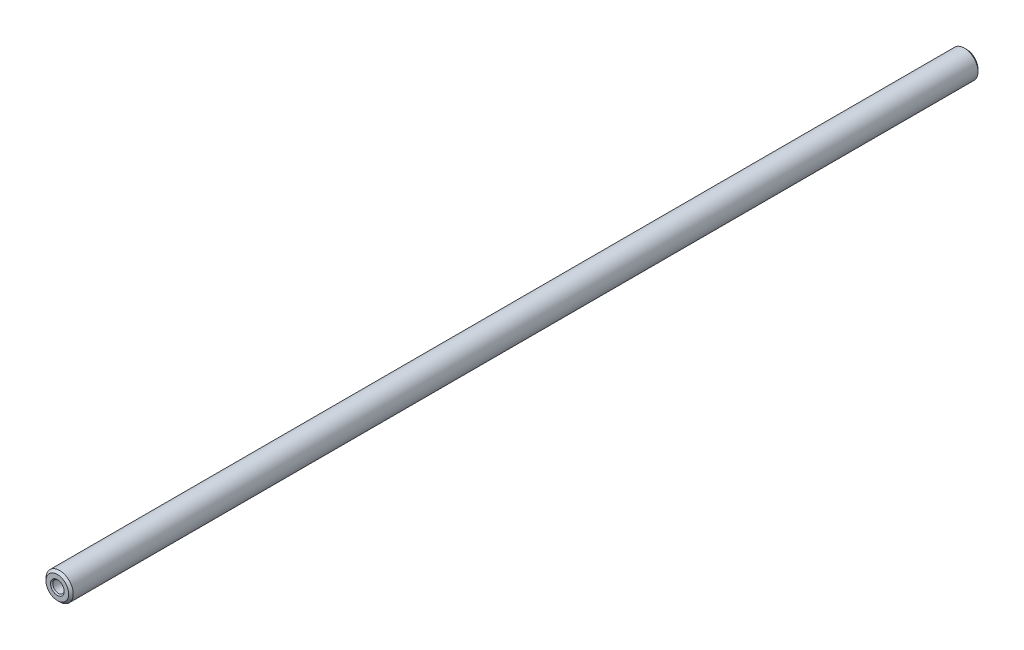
SolidWorks part; units mm, degrees
ref_plane "Front Plane" through (0, 0, 0) normal (0, 0, 1) x (1, 0, 0)
ref_plane "Top Plane" through (0, 0, 0) normal (0, 1, 0) x (1, 0, 0)
ref_plane "Right Plane" through (0, 0, 0) normal (1, 0, 0) x (0, 0, -1)
sketch "Sketch1" plane through (0, 0, 0) normal (0, 0, 1) x (1, 0, 0)
  circle A0 centre (0, 0) radius 2.995
  dimension "D1" = 5.99
extrude "Boss-Extrude1" add sketch "Sketch1" along normal blind 200
chamfer "Chamfer1" distance 0.5 angle 45 2 edges at (2.995, 0, 0) (2.995, 0, 200)
hole_wizard "M3x0.5 Tapped Hole1" positions "Sketch3" profile "Sketch5" tap size "M3x0.5" standard "Ansi Metric"
sketch "Sketch3" plane through (-0.0864, -0.0239, 0) normal (0, 0, -1) x (-1, 0, 0)
  point P0 (-0.0864, 0.0239)
sketch "Sketch5" plane through (0, 0, 0) normal (1, 0, 0) x (0, 1, 0)
  line L0 (0, 0) -> (0, 3.7511)
  line L1 (0, 3.7511) -> (1.25, 3)
  line L2 (1.25, 3) -> (1.25, 0.25)
  line L3 (1.25, 0.25) -> (1.5, 0)
  line L5 (1.5, 0) -> (0, 0)
  line L6 (-1.25, 0.25) -> (-1.5, 0) construction
  line L10 (0, 3.7511) -> (-1.25, 3) construction
  line L11 (0, -6.35) -> (0, 107.95) construction
  dimension "Tap Drill Dia." = 2.5
  dimension "Tap Drill Depth" = 3
  dimension "Near C'Sink Dia." = 3
  dimension "Near C'Sink Angle" = 90
  dimension "Drill Angle" = 118
hole_wizard "M3x0.5 Tapped Hole2" positions "Sketch7" profile "Sketch9" tap size "M3x0.5" standard "Ansi Metric"
sketch "Sketch7" plane through (0.0274, -0.3308, 200) normal (0, 0, 1) x (1, 0, 0)
  point P0 (-0.0274, 0.3308)
sketch "Sketch9" plane through (0, 0, 200) normal (1, 0, 0) x (0, -1, 0)
  line L0 (0, 0) -> (0, 3.7511)
  line L1 (0, 3.7511) -> (1.25, 3)
  line L2 (1.25, 3) -> (1.25, 0.25)
  line L3 (1.25, 0.25) -> (1.5, 0)
  line L5 (1.5, 0) -> (0, 0)
  line L6 (-1.25, 0.25) -> (-1.5, 0) construction
  line L10 (0, 3.7511) -> (-1.25, 3) construction
  line L11 (0, -6.35) -> (0, 107.95) construction
  dimension "Tap Drill Dia." = 2.5
  dimension "Tap Drill Depth" = 3
  dimension "Near C'Sink Dia." = 3
  dimension "Near C'Sink Angle" = 90
  dimension "Drill Angle" = 118
